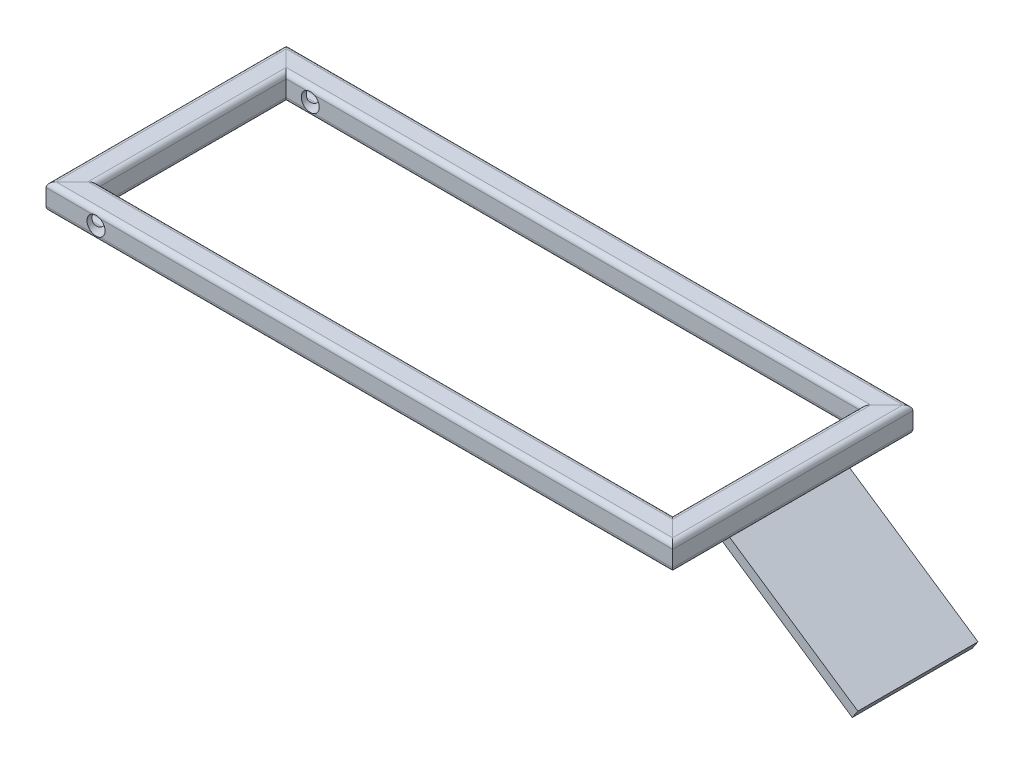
SolidWorks part; units mm, degrees
ref_plane "Front Plane" through (0, 0, 0) normal (0, 0, 1) x (1, 0, 0)
ref_plane "Top Plane" through (0, 0, 0) normal (0, 1, 0) x (1, 0, 0)
ref_plane "Right Plane" through (0, 0, 0) normal (1, 0, 0) x (0, 0, -1)
sketch "Sketch1" plane through (0, 0, 0) normal (0, 1, 0) x (1, 0, 0)
  line L1 (-150, 53.5) -> (150, 53.5)
  line L2 (-150, 53.5) -> (-150, -53.5)
  line L3 (-150, -53.5) -> (150, -53.5)
  line L4 (150, 53.5) -> (150, -53.5)
  line L5 (-150, 53.5) -> (150, -53.5) construction
  line L6 (-150, -53.5) -> (150, 53.5) construction
  point P0 (0, 0)
  dimension "D1" = 107
  dimension "D2" = 300
other "Round edge 13 X 13 X 2.5(1)"
ref_plane "Plane1" through (-150, 0, -53.5) normal (1, 0, 0) x (0, 0, -1)
sketch "Sketch11" plane through (-150, 0, -53.5) normal (1, 0, 0) x (0, 0, -1)
  line L1 (-1.5, 4) -> (1.5, 4)
  line L2 (-4, 1.5) -> (-4, -1.5)
  line L3 (-1.5, -4) -> (1.5, -4)
  line L4 (4, 1.5) -> (4, -1.5)
  line L5 (-4, 4) -> (4, -4) construction
  line L6 (-4, -4) -> (4, 4) construction
  line L7 (-4, 6.5) -> (4, 6.5)
  line L8 (-6.5, 4) -> (-6.5, -4)
  line L9 (-4, -6.5) -> (4, -6.5)
  line L10 (6.5, 4) -> (6.5, -4)
  line L11 (-6.5, 6.5) -> (6.5, -6.5) construction
  line L12 (-6.5, -6.5) -> (6.5, 6.5) construction
  arc A0 (-4, -1.5) -> (-1.5, -4) centre (-1.5, -1.5) ccw
  arc A1 (1.5, -4) -> (4, -1.5) centre (1.5, -1.5) ccw
  arc A2 (1.5, 4) -> (4, 1.5) centre (1.5, 1.5) cw
  arc A3 (-1.5, 4) -> (-4, 1.5) centre (-1.5, 1.5) ccw
  arc A4 (-6.5, -4) -> (-4, -6.5) centre (-4, -4) ccw
  arc A5 (4, -6.5) -> (6.5, -4) centre (4, -4) ccw
  arc A6 (4, 6.5) -> (6.5, 4) centre (4, 4) cw
  arc A7 (-4, 6.5) -> (-6.5, 4) centre (-4, 4) ccw
  point P0 (0, 0)
  point P6 (0, 0)
  point P35 (0, 0)
  dimension "D4" = 2.5
  dimension "D5" = 2.5
  dimension "D1" = 13
  dimension "D2" = 13
  dimension "D3" = 2.5
sketch "Sketch12" plane through (0, 0, 0) normal (0, 0, 1) x (1, 0, 0)
  line L0 (-156.5, 4) -> (-156.5, -4) construction
  line L1 (-154, 6.5) -> (154, 6.5) construction
  circle A0 centre (-131.5, 0) radius 4.5
  dimension "D2" = 9
  dimension "D1" = 25
  dimension "D3" = 6.5
extrude "Cut-Extrude1" cut sketch "Sketch12" against normal through all both and the other way through all
sketch "Sketch13" plane through (0, 0, 0) normal (0, 0, 1) x (1, 0, 0)
  line L0 (146, -6.5) -> (216.2361, -53.8748)
  line L1 (216.2361, -53.8748) -> (219.032, -49.7296)
  line L2 (219.032, -49.7296) -> (154.9415, -6.5)
  line L3 (154.9415, -6.5) -> (146, -6.5)
  dimension "D1" = 5
  dimension "D2" = 146
  dimension "D3" = 84.72
extrude "Boss-Extrude1" add sketch "Sketch13" along normal mid plane 60 separate body
